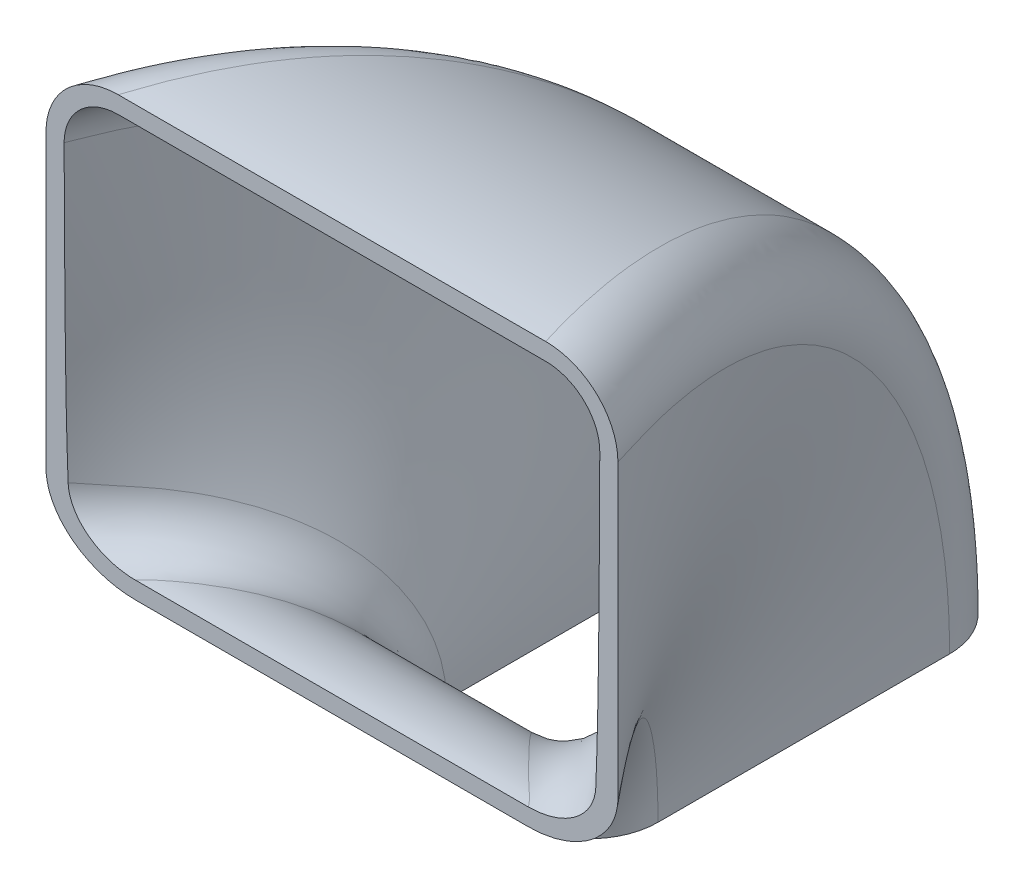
SolidWorks part; units mm, degrees
ref_plane "Front" through (0, 0, 0) normal (0, 0, 1) x (1, 0, 0)
ref_plane "Top" through (0, 0, 0) normal (0, 1, 0) x (1, 0, 0)
ref_plane "Right" through (0, 0, 0) normal (1, 0, 0) x (0, 0, -1)
imported_body "Surface-Imported1"
imported_body "Surface-Imported2"
loft "Loft1" add
fillet "Fillet1" radius 12 4 edges
shell "Shell1" thickness 3
